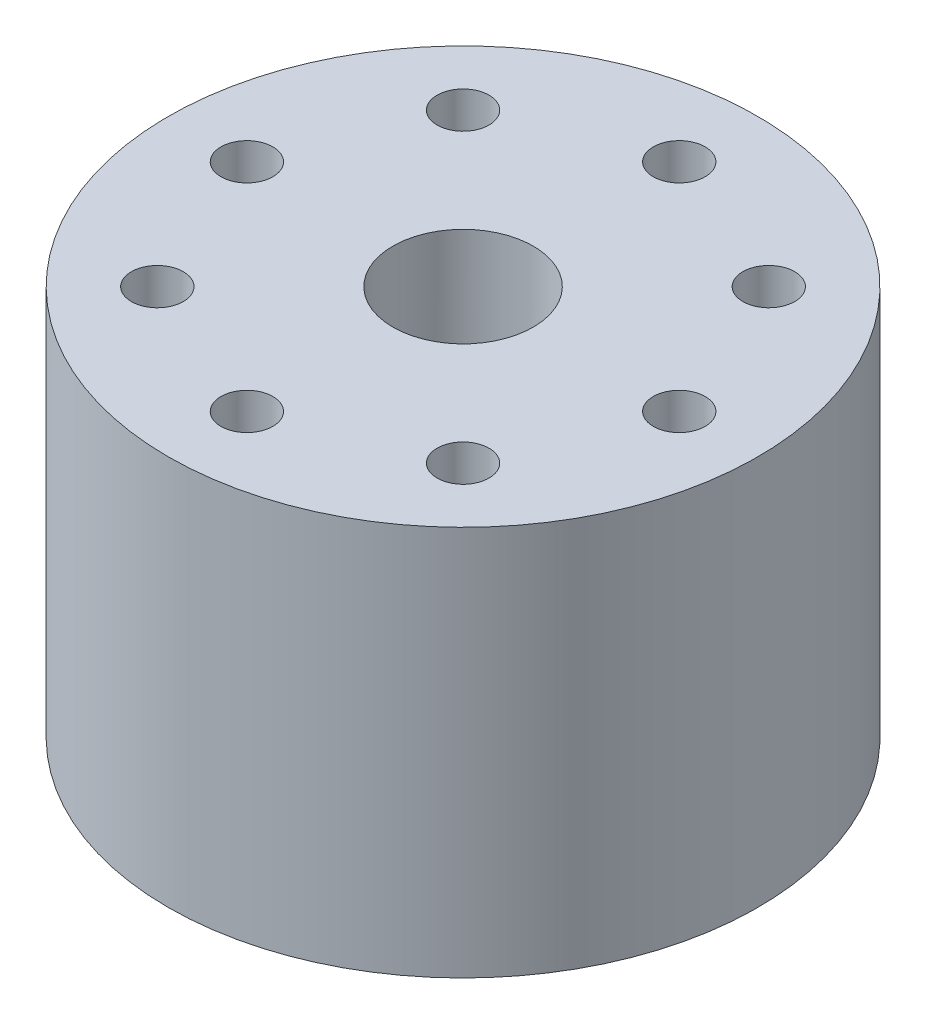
SolidWorks part; units mm, degrees
ref_plane "Front Plane" through (0, 0, 0) normal (0, 0, 1) x (1, 0, 0)
ref_plane "Top Plane" through (0, 0, 0) normal (0, 1, 0) x (1, 0, 0)
ref_plane "Right Plane" through (0, 0, 0) normal (1, 0, 0) x (0, 0, -1)
sketch "Sketch1" plane through (0, 0, 0) normal (0, 1, 0) x (1, 0, 0)
  circle A0 centre (0, 0) radius 37.5
  dimension "D1" = 75
extrude "Outer Cylinder" add sketch "Sketch1" along normal blind 49.65
sketch "Sketch2" plane through (0, 49.65, 0) normal (0, 1, 0) x (1, 0, 0)
  circle A0 centre (0, 0) radius 8.93
  dimension "D1" = 17.86
extrude "NPT Hole" cut sketch "Sketch2" against normal blind 23
sketch "Sketch3" plane through (0, 0, 0) normal (0, -1, 0) x (1, 0, 0)
  circle A0 centre (0, 0) radius 12
  dimension "D1" = 24
extrude "Outer Leaflet Diameter" cut sketch "Sketch3" against normal blind 5
sketch "Sketch4" plane through (0, 0, 0) normal (0, -1, 0) x (1, 0, 0)
  circle A0 centre (0, 0) radius 16
  dimension "D1" = 32
extrude "Depth" cut sketch "Sketch4" against normal blind 3.15
ref_plane "Plane1" through (0, 3.15, 0) normal (0, -1, 0) x (-1, 0, 0)
sketch "Sketch6" plane through (0, 0, 0) normal (0, 0, 1) x (1, 0, 0)
  line L0 (0, 3.15) -> (-12, 3.15)
  line L1 (-16, 3.15) -> (16, 3.15) construction
  line L2 (0, 3.15) -> (0, 20.19)
  line L3 (0, 20.19) -> (-12, 20.19)
  spline S0 degree 2 poles (-12, 20.19) (-19.2, 11.67) (-12, 3.15) knots 0 0 0 1 1 1
revolve "Aortic Root" cut sketch "Sketch6" angle 360 about L2
ref_plane "Plane3" through (0, 26.65, 0) normal (0, 1, 0) x (1, 0, 0)
ref_plane "Plane5" through (0, 20.19, 0) normal (0, -1, 0) x (-1, 0, 0)
sketch "Sketch8" plane through (0, 0, 0) normal (0, 0, 1) x (1, 0, 0)
  line L0 (0, 26.65) -> (0, 20.19)
  line L1 (8.93, 26.65) -> (-8.93, 26.65) construction
  line L2 (-12, 20.19) -> (12, 20.19) construction
  line L3 (0, 20.19) -> (-12, 20.19)
  line L4 (-12, 20.19) -> (-12, 26.65)
  line L5 (-12, 26.65) -> (0, 26.65)
revolve "Ascending Aorta" cut sketch "Sketch8" angle 360 about L0
sketch "Sketch9" plane through (0, 49.65, 0) normal (0, 1, 0) x (1, 0, 0)
  line L0 (0, 0) -> (0, -27.5) construction
  line L1 (0, 0) -> (-19.4454, -19.4454) construction
  circle A0 centre (0, -27.5) radius 3.3
  circle A1 centre (0, 0) radius 27.5
  circle A2 centre (-19.4454, -19.4454) radius 3.3
  circle A3 centre (-27.5, 0) radius 3.3
  circle A4 centre (-19.4454, 19.4454) radius 3.3
  circle A5 centre (0, 27.5) radius 3.3
  circle A6 centre (19.4454, 19.4454) radius 3.3
  circle A7 centre (27.5, 0) radius 3.3
  circle A8 centre (19.4454, -19.4454) radius 3.3
  dimension "D1" = 6.6
  dimension "D3" = 55
  dimension "D2" = 27.5
  dimension "D5" = 45
  dimension "D4" = 8
extrude "Bolt Holes" cut sketch "Sketch9" against normal through all contours A1 A8 | A1 A7 | A1 A6 | A1 A6 | A1 A5 | A1 A5 | A1 A4 | A1 A4 | A1 A3 | A1 A3 | A1 A2 | A1 A2 | A0 A1 | A1 A0 | A1 A8
chamfer "Chamfer3" distance 3 angle 60 1 edges at (0, 26.65, 8.93)
equation "\"A\"= 24"
equation "\"Outer Leaflet Diameter\"= \"A\""
equation "\"Aortic Root Height\"= .71 * \"A\""
equation "\"D2@Sketch6\"= \"A\" / 2"
equation "\"D3@Sketch6\"=\"A\"/2"
equation "\"Max Diameter Height\"= \"A\" * ( .71 / 2 )"
equation "\"Max Diameter\"= \"A\" * ( .65 )"
equation "\"D2@Sketch8\"=\"A\"/2"
